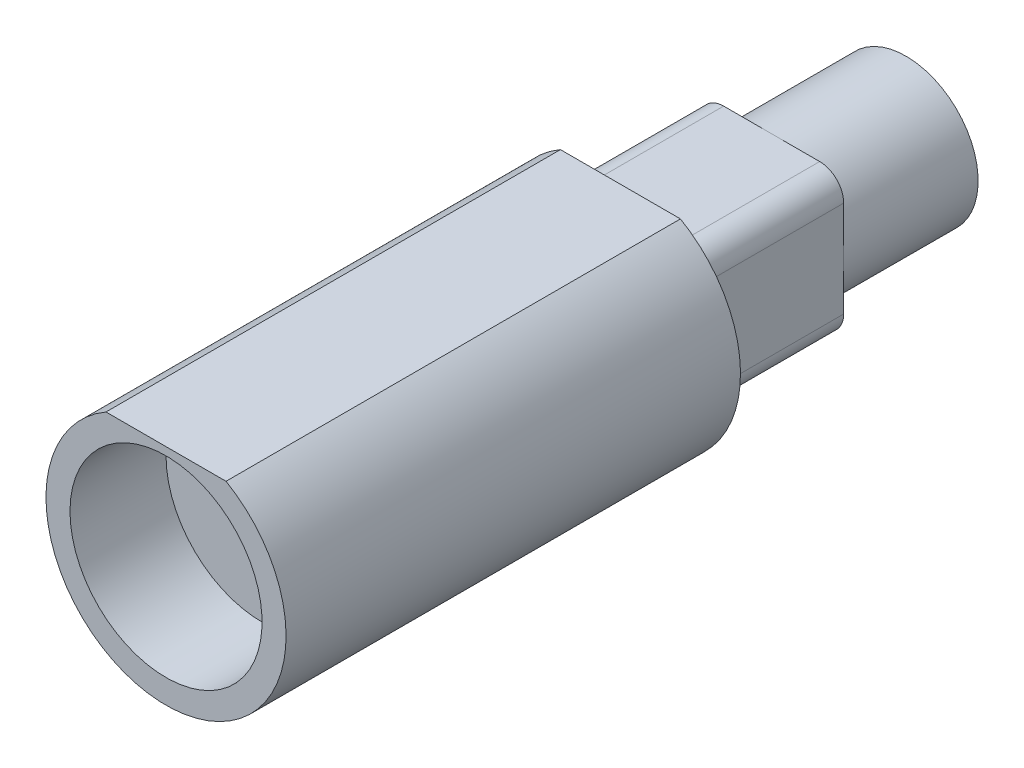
SolidWorks part; units mm, degrees
ref_plane "Front Plane" through (0, 0, 0) normal (0, 0, 1) x (1, 0, 0)
ref_plane "Top Plane" through (0, 0, 0) normal (0, 1, 0) x (1, 0, 0)
ref_plane "Right Plane" through (0, 0, 0) normal (1, 0, 0) x (0, 0, -1)
sketch "Sketch1" plane through (0, 0, 0) normal (0, 0, 1) x (1, 0, 0)
  circle A1 centre (0, 0) radius 7.9375 construction
sketch "Sketch2" plane through (0, 0, 0) normal (1, 0, 0) x (0, 0, -1)
  line L0 (-152.4, 7.9375) -> (152.4, 7.9375) construction
  line L1 (0, 7.9375) -> (0, -7.9375) construction
  line L2 (0, 7.9375) -> (0, -7.9375) construction
  point P2 (0, 7.9375)
  point P3 (120.65, 7.9375)
  point P4 (-120.65, 7.9375)
sketch "Sketch3" plane through (0, 0, 0) normal (0, 0, 1) x (1, 0, 0)
  circle A1 centre (0, 0) radius 7.9375 construction
  circle A3 centre (0, 0) radius 7.9375
extrude "Boss-Extrude2" add sketch "Sketch3" along normal up to vertex (152.4 mm away) and the other way up to vertex (152.4 mm away)
sketch "Sketch10" plane through (0, 0, 0) normal (0, 0, 1) x (1, 0, 0)
  line L0 (-3.9688, 6.8741) -> (3.9688, 6.8741)
  line L1 (0, 0) -> (0, 7.9375) construction
  circle A0 centre (0, 0) radius 7.9375 construction
  circle A1 centre (0, 0) radius 7.9375 construction
  arc A2 (-3.9688, 6.8741) -> (3.9688, 6.8741) centre (0, 0) cw
extrude "Cut-Extrude5" cut sketch "Sketch10" against normal through all both and the other way through all
chamfer "Chamfer1" distance 0.7937 angle 45 4 edges at (0, -7.9375, 152.4) (0, -7.9375, -152.4) (0, 6.8741, -152.4) (0, 6.8741, 152.4)
sketch "Sketch11" plane through (0, 0, -152.4) normal (0, 0, -1) x (-1, 0, 0)
  line L0 (9.965, 7.451) -> (23.8708, 20.9344) construction
  line L1 (-11.6299, -9.0653) -> (11.6299, -9.0653)
  line L2 (-11.6299, -9.0653) -> (-11.6299, 9.0653)
  line L3 (-11.6299, 9.0653) -> (11.6299, 9.0653)
  line L4 (11.6299, -9.0653) -> (11.6299, 9.0653)
  line L5 (-11.6299, -9.0653) -> (11.6299, 9.0653) construction
  line L6 (-11.6299, 9.0653) -> (11.6299, -9.0653) construction
  circle A0 centre (0, 0) radius 4.7625
  dimension "D1" = 9.525
extrude "Cut-Extrude6" cut sketch "Sketch11" against normal blind 6.35 contours L3 L4 L1 L2 | A0
ref_plane "Plane1" through (-4.7625, 4.7625, -146.05) normal (0, 1, 0) x (1, 0, 0)
ref_plane "Plane2" through (-3.9688, 6.8741, -146.05) normal (-0.866, -0.5, 0) x (0, 0, 1)
sketch "Sketch14" plane through (0, 0, -146.05) normal (0, 0, -1) x (-1, 0, 0)
  line L0 (-4.7625, 4.7625) -> (-4.7625, -4.7625) construction
  line L1 (4.7625, -4.7625) -> (-4.7625, -4.7625)
  line L2 (4.7625, -4.7625) -> (4.7625, 4.7625)
  line L3 (4.7625, 4.7625) -> (-4.7625, 4.7625)
  line L4 (-4.7625, -4.7625) -> (-4.7625, 4.7625)
  line L5 (4.7625, -4.7625) -> (-4.7625, 4.7625) construction
  line L6 (4.7625, 4.7625) -> (-4.7625, -4.7625) construction
  line L8 (4.7625, 4.7625) -> (-4.7625, 4.7625)
  line L9 (4.7625, 4.7625) -> (4.7625, -4.7625)
  line L10 (4.7625, -4.7625) -> (-4.7625, -4.7625)
  line L11 (-4.7625, 4.7625) -> (-4.7625, -4.7625)
  line L12 (4.7625, 4.7625) -> (-4.7625, -4.7625) construction
  line L13 (4.7625, -4.7625) -> (-4.7625, 4.7625) construction
  line L14 (15.3238, -13.9507) -> (-15.3238, -13.9507)
  line L15 (15.3238, -13.9507) -> (15.3238, 13.9507)
  line L16 (15.3238, 13.9507) -> (-15.3238, 13.9507)
  line L17 (-15.3238, -13.9507) -> (-15.3238, 13.9507)
  line L18 (15.3238, -13.9507) -> (-15.3238, 13.9507) construction
  line L19 (15.3238, 13.9507) -> (-15.3238, -13.9507) construction
  spline S0 degree 3 poles (-23.3744, 21.4872) (-20.6827, 18.9713) (-17.9916, 16.4548) (-13.962, 12.6725) (-12.6198, 11.4106) (-10.6131, 9.5111) (-9.9453, 8.8769) (-8.6156, 7.6027) (-7.9529, 6.9634) (-7.2999, 6.3145) knots 0 0 0 0 0.5 0.5 0.75 0.75 0.875 0.875 1 1 1 1 construction
  point P0 (0, 0)
  point P8 (0, 0)
  point P13 (0, 0)
  dimension "D1" = 9.525
  dimension "D2" = 9.525
extrude "Cut-Extrude7" cut sketch "Sketch14" against normal blind 10 contours L14 L17 L16 L15 | L1 L4 L3 L2
sketch "Sketch15" plane through (0, 0, 0) normal (0, 1, 0) x (1, 0, 0)
  line L1 (-7.9375, 106.0015) -> (-7.9375, -174.2193)
  line L2 (-7.9375, -174.2193) -> (0, -174.2193)
  line L3 (0, -174.2193) -> (0, 112.3515)
  line L4 (0, 0) -> (0, -223.4962) construction
  line L5 (4.7625, 152.4) -> (-4.7625, 152.4) construction
  line L6 (-7.9375, 136.05) -> (-7.9375, -151.6063) construction
  line L7 (-7.9375, 136.05) -> (-7.9375, -151.6063) construction
  line L8 (-7.9375, 106.0015) -> (-6.35, 106.0015)
  line L9 (-6.35, 106.0015) -> (-6.35, 112.3515)
  line L10 (-6.35, 112.3515) -> (0, 112.3515)
  dimension "D1" = 6.35
  dimension "D2" = 6.35
  dimension "D3" = 46.3985
revolve "Cut-Revolve1" cut sketch "Sketch15" angle 360 about L4
fillet "Fillet6" radius 1.5875 4 edges at (-4.7625, 4.7625, -141.05) (4.7625, 4.7625, -141.05) (-4.7625, -4.7625, -141.05) (4.7625, -4.7625, -141.05)
sketch "Sketch17" plane through (0, 0, -152.4) normal (0, 0, -1) x (-1, 0, 0)
  circle A0 centre (0, 0) radius 4.7625
extrude "Boss-Extrude3" add sketch "Sketch17" along normal blind 2.54
equation "\"D1@Chamfer1\"= \"Diameter@Sketch1\" / 20"
equation "\"D1@Sketch2\"=\"Diameter@Sketch1\"*2"
equation "\"D2@Sketch2\"=\"D1@Sketch2\""
